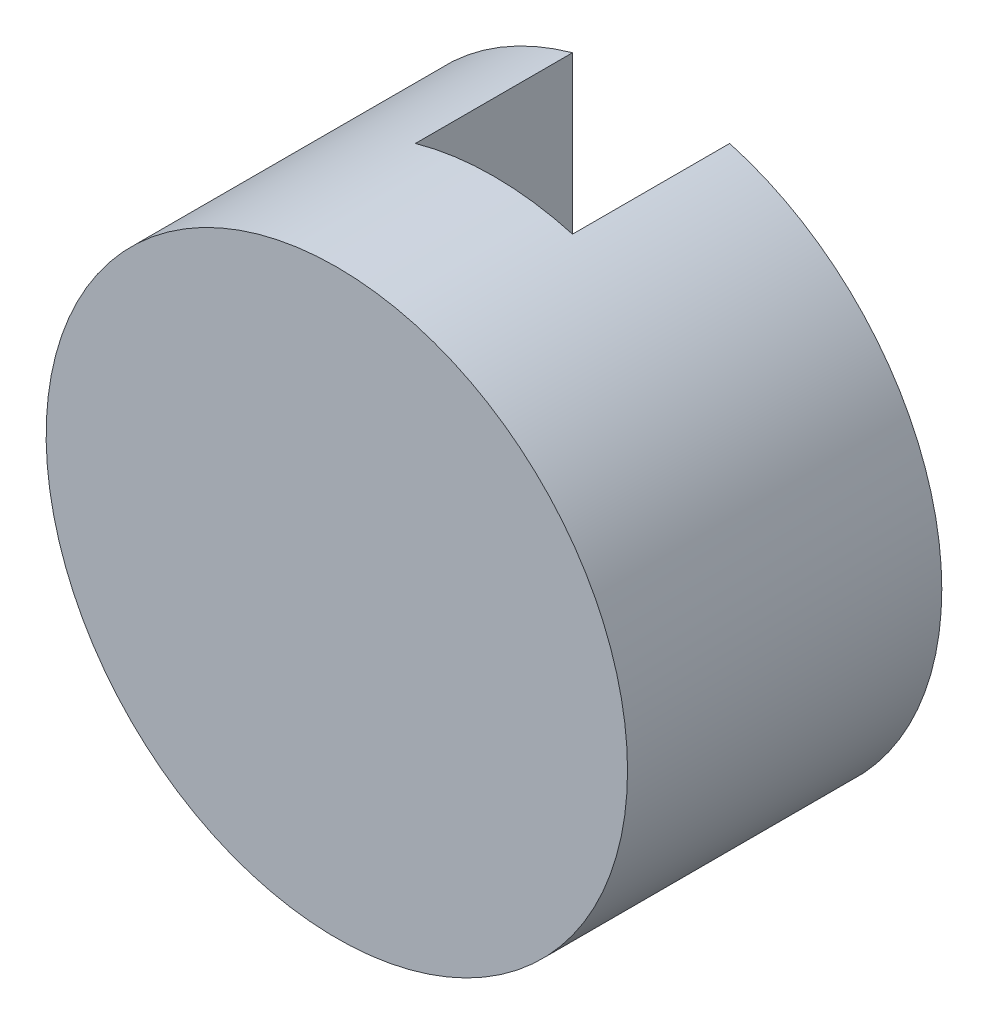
SolidWorks part; units mm, degrees
ref_plane "Plano frontal" through (0, 0, 0) normal (0, 0, 1) x (1, 0, 0)
ref_plane "Plano superior" through (0, 0, 0) normal (0, 1, 0) x (1, 0, 0)
ref_plane "Plano direito" through (0, 0, 0) normal (1, 0, 0) x (0, 0, -1)
sketch "Esboço1" plane through (0, 0, 0) normal (0, 0, 1) x (1, 0, 0)
  circle A0 centre (-36.8193, 12.6461) radius 1.85
extrude "Ressalto-extrusão1" add sketch "Esboço1" along normal blind 2
sketch "Esboço2" plane through (0, 0, 0) normal (0, 0, -1) x (-1, 0, 0)
  line L0 (36.3193, 15.2638) -> (37.3193, 15.2638)
  line L2 (37.3193, 15.2638) -> (37.3193, 10.1337)
  line L3 (37.3193, 10.1337) -> (36.3193, 10.1337)
  line L4 (36.3193, 15.2638) -> (36.3193, 10.1337)
extrude "Corte-extrusão1" cut sketch "Esboço2" against normal blind 1
